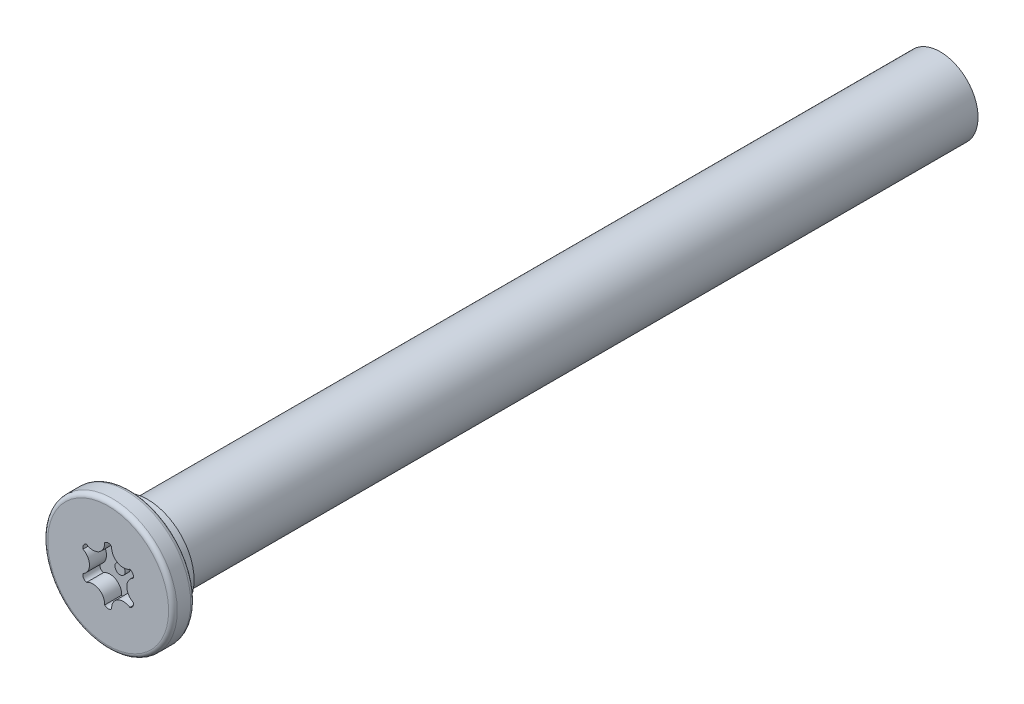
SolidWorks part; units mm, degrees
ref_plane "Front Plane" through (0, 0, 0) normal (0, 0, 1) x (1, 0, 0)
ref_plane "Top Plane" through (0, 0, 0) normal (0, 1, 0) x (1, 0, 0)
ref_plane "Right Plane" through (0, 0, 0) normal (1, 0, 0) x (0, 0, -1)
sketch "Sketch2" plane through (0, 0, 0) normal (1, 0, 0) x (0, 0, -1)
  line L1 (0, 0) -> (1.3, 0)
  line L2 (0, 0) -> (0, 3.81)
  line L3 (0, 3.81) -> (1.3, 3.81)
  line L4 (1.3, 0) -> (1.3, 3.81)
  line L5 (1.3, 0) -> (14, 0)
  line L6 (1.3, 0) -> (1.3, 2.23)
  line L7 (1.3, 2.23) -> (14, 2.23)
  line L8 (14, 0) -> (14, 2.23)
  dimension "D1" = 3.81
  dimension "D2" = 1.3
  dimension "D3" = 12.7
  dimension "D4" = 2.23
revolve "Revolve1" add sketch "Sketch2" angle 360 about L5
sketch "Sketch3" plane through (0, 0, 0) normal (0, 0, 1) x (1, 0, 0)
  line L0 (0, 1.3843) -> (0, 0)
  line L3 (1.1845, -1.0048) -> (2.4257, -1.0048)
  line L4 (0, 1.675) -> (0, 1.6727)
  line L5 (0, 1.675) -> (0, 1.6727)
  line L6 (0, 1.6727) -> (0, 1.675)
  line L8 (1.0407, 1.8026) -> (1.1012, 1.9073)
  line L9 (1.3857, 1.205) -> (2.5818, 1.205)
  line L10 (0, 0) -> (0.8375, 1.4506)
  line L11 (0, 0) -> (2.5818, 0)
  line L14 (2.5818, 0) -> (2.5818, 1.205)
  line L15 (1.3857, 1.205) -> (-0.1691, 1.205)
  circle A0 centre (0, 0) radius 1.675
  arc A7 (1.1845, -1.0048) -> (1.0345, -1.0748) centre (0.8546, -0.4934) cw
  arc A16 (-0.2051, 1.5894) -> (0.2051, 1.5894) centre (0, 1.3843) cw
  arc A18 (0.2051, 1.5894) -> (1.2739, 0.9723) centre (0.8938, 1.5482) ccw
  arc A19 (1.479, 0.6171) -> (1.479, -0.6171) centre (1.7877, 0) ccw
  arc A20 (1.2739, 0.9723) -> (1.479, 0.6171) centre (1.1988, 0.6922) cw
  arc A21 (1.2739, -0.9723) -> (0.2051, -1.5894) centre (0.8938, -1.5482) ccw
  arc A22 (1.479, -0.6171) -> (1.2739, -0.9723) centre (1.1988, -0.6922) cw
  arc A23 (-0.2051, -1.5894) -> (-1.2739, -0.9723) centre (-0.8938, -1.5482) ccw
  arc A24 (0.2051, -1.5894) -> (-0.2051, -1.5894) centre (0, -1.3843) cw
  arc A25 (-1.479, -0.6171) -> (-1.479, 0.6171) centre (-1.7877, 0) ccw
  arc A26 (-1.2739, -0.9723) -> (-1.479, -0.6171) centre (-1.1988, -0.6922) cw
  arc A27 (-1.2739, 0.9723) -> (-0.2051, 1.5894) centre (-0.8938, 1.5482) ccw
  arc A28 (-1.479, 0.6171) -> (-1.2739, 0.9723) centre (-1.1988, 0.6922) cw
  point P38 (0, 0)
  point P52 (0, 0)
  dimension "D1" = 3.35
  dimension "D4" = 1.205
  dimension "D2" = 6
  dimension "D5" = 60
extrude "Cut-Extrude3" cut sketch "Sketch3" against normal blind 1
fillet "Fillet12" radius 0.254 2 edges at (3.81, 0, 0) (3.81, 0, -1.3)
sketch "Sketch7" plane through (0, 0, -14) normal (0, 0, -1) x (-1, 0, 0)
  circle A0 centre (0, 0) radius 2.23
  dimension "D1" = 4.46
extrude "Cut-Extrude6" cut sketch "Sketch7" against normal blind 12.7
sketch "Sketch11" plane through (0, 0, -1.3) normal (0, 0, -1) x (-1, 0, 0)
  circle A0 centre (0, 0) radius 2.23
  circle A1 centre (0, 0) radius 2.738
extrude "Boss-Extrude1" add sketch "Sketch11" along normal blind 1.016
sketch "Sketch12" plane through (0, 0, -1.3) normal (0, 0, -1) x (-1, 0, 0)
  circle A0 centre (0, 0) radius 2.23
extrude "Boss-Extrude2" add sketch "Sketch12" along normal blind 12.7
sketch "Sketch14" plane through (0, 0, -1) normal (0, 0, 1) x (1, 0, 0)
  circle A0 centre (0, 0) radius 0.3
extrude "Boss-Extrude4" add sketch "Sketch14" along normal blind 0.3
sketch "Sketch15" plane through (0, 0, -14) normal (0, 0, -1) x (-1, 0, 0)
  circle A0 centre (0, 0) radius 2.23
extrude "Cut-Extrude7" cut sketch "Sketch15" against normal blind 12.7
sketch "Sketch16" plane through (0, 0, -1.3) normal (0, 0, -1) x (-1, 0, 0)
  circle A0 centre (0, 0) radius 2.23
extrude "Boss-Extrude5" add sketch "Sketch16" along normal blind 47.625
